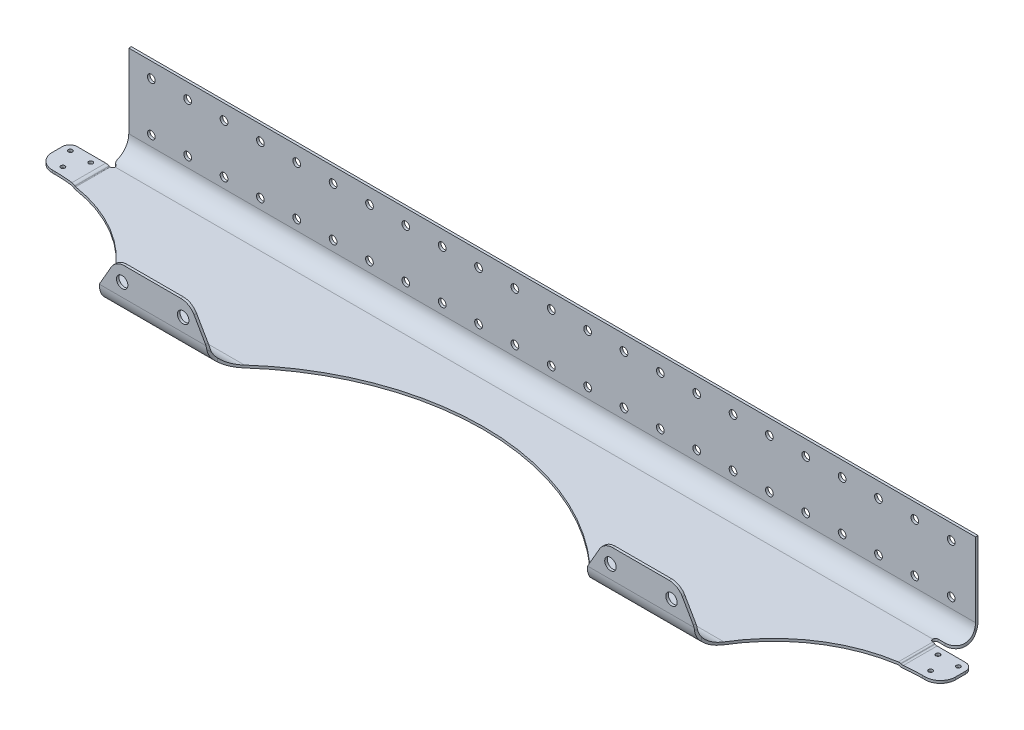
SolidWorks part; units mm, degrees
ref_plane "Front Plane" through (0, 0, 0) normal (1, 0, 0) x (0, 1, 0)
ref_plane "Top Plane" through (0, 0, 0) normal (0, 0, 1) x (0, 1, 0)
ref_plane "Right Plane" through (0, 0, 0) normal (0, 1, 0) x (-1, 0, 0)
sketch "sk 5dia hole pat" plane through (0, 0, 0) normal (0, 0, 1) x (0, 1, 0)
  line L4 (-30.48, -48.26) -> (30.48, -48.26) construction
  point P3 (0, -48.26)
  circle B0 centre (30.48, -579.12) radius 4.826
  circle B1 centre (1188.72, 579.12) radius 4.826
  circle B2 centre (78.74, -579.12) radius 4.826
  circle B3 centre (127, -579.12) radius 4.826
  circle B4 centre (175.26, -579.12) radius 4.826
  circle B5 centre (223.52, -579.12) radius 4.826
  circle B6 centre (271.78, -579.12) radius 4.826
  circle B7 centre (320.04, -579.12) radius 4.826
  circle B8 centre (368.3, -579.12) radius 4.826
  circle B9 centre (416.56, -579.12) radius 4.826
  circle B10 centre (464.82, -579.12) radius 4.826
  circle B11 centre (513.08, -579.12) radius 4.826
  circle B12 centre (561.34, -579.12) radius 4.826
  circle B13 centre (609.6, -579.12) radius 4.826
  circle B14 centre (657.86, -579.12) radius 4.826
  circle B15 centre (706.12, -579.12) radius 4.826
  circle B16 centre (754.38, -579.12) radius 4.826
  circle B17 centre (802.64, -579.12) radius 4.826
  circle B18 centre (850.9, -579.12) radius 4.826
  circle B19 centre (899.16, -579.12) radius 4.826
  circle B20 centre (947.42, -579.12) radius 4.826
  circle B21 centre (995.68, -579.12) radius 4.826
  circle B22 centre (1043.94, -579.12) radius 4.826
  circle B23 centre (1092.2, -579.12) radius 4.826
  circle B24 centre (1140.46, -579.12) radius 4.826
  circle B25 centre (1188.72, -579.12) radius 4.826
  circle B26 centre (30.48, -530.86) radius 4.826
  circle B27 centre (30.48, -482.6) radius 4.826
  circle B28 centre (30.48, -434.34) radius 4.826
  circle B29 centre (30.48, -386.08) radius 4.826
  circle B30 centre (30.48, -337.82) radius 4.826
  circle B31 centre (30.48, -289.56) radius 4.826
  circle B32 centre (30.48, -241.3) radius 4.826
  circle B33 centre (30.48, -193.04) radius 4.826
  circle B34 centre (30.48, -144.78) radius 4.826
  circle B35 centre (30.48, -96.52) radius 4.826
  circle B36 centre (30.48, -48.26) radius 4.826
  circle B37 centre (30.48, 0) radius 4.826
  circle B38 centre (30.48, 48.26) radius 4.826
  circle B39 centre (30.48, 96.52) radius 4.826
  circle B40 centre (30.48, 144.78) radius 4.826
  circle B41 centre (30.48, 193.04) radius 4.826
  circle B42 centre (30.48, 241.3) radius 4.826
  circle B43 centre (30.48, 289.56) radius 4.826
  circle B44 centre (30.48, 337.82) radius 4.826
  circle B45 centre (30.48, 386.08) radius 4.826
  circle B46 centre (30.48, 434.34) radius 4.826
  circle B47 centre (30.48, 482.6) radius 4.826
  circle B48 centre (30.48, 530.86) radius 4.826
  circle B49 centre (30.48, 579.12) radius 4.826
  circle B50 centre (1140.46, 579.12) radius 4.826
  circle B51 centre (1092.2, 579.12) radius 4.826
  circle B52 centre (1043.94, 579.12) radius 4.826
  circle B53 centre (995.68, 579.12) radius 4.826
  circle B54 centre (947.42, 579.12) radius 4.826
  circle B55 centre (899.16, 579.12) radius 4.826
  circle B56 centre (850.9, 579.12) radius 4.826
  circle B57 centre (802.64, 579.12) radius 4.826
  circle B58 centre (754.38, 579.12) radius 4.826
  circle B59 centre (706.12, 579.12) radius 4.826
  circle B60 centre (657.86, 579.12) radius 4.826
  circle B61 centre (609.6, 579.12) radius 4.826
  circle B62 centre (561.34, 579.12) radius 4.826
  circle B63 centre (513.08, 579.12) radius 4.826
  circle B64 centre (464.82, 579.12) radius 4.826
  circle B65 centre (416.56, 579.12) radius 4.826
  circle B66 centre (368.3, 579.12) radius 4.826
  circle B67 centre (320.04, 579.12) radius 4.826
  circle B68 centre (271.78, 579.12) radius 4.826
  circle B69 centre (223.52, 579.12) radius 4.826
  circle B70 centre (175.26, 579.12) radius 4.826
  circle B71 centre (127, 579.12) radius 4.826
  circle B72 centre (78.74, 579.12) radius 4.826
  circle B73 centre (1188.72, 530.86) radius 4.826
  circle B74 centre (1188.72, 482.6) radius 4.826
  circle B75 centre (1188.72, 434.34) radius 4.826
  circle B76 centre (1188.72, 386.08) radius 4.826
  circle B77 centre (1188.72, 337.82) radius 4.826
  circle B78 centre (1188.72, 289.56) radius 4.826
  circle B79 centre (1188.72, 241.3) radius 4.826
  circle B80 centre (1188.72, 193.04) radius 4.826
  circle B81 centre (1188.72, 144.78) radius 4.826
  circle B82 centre (1188.72, 96.52) radius 4.826
  circle B83 centre (1188.72, 48.26) radius 4.826
  circle B84 centre (1188.72, 0) radius 4.826
  circle B85 centre (1188.72, -48.26) radius 4.826
  circle B86 centre (1188.72, -96.52) radius 4.826
  circle B87 centre (1188.72, -144.78) radius 4.826
  circle B88 centre (1188.72, -193.04) radius 4.826
  circle B89 centre (1188.72, -241.3) radius 4.826
  circle B90 centre (1188.72, -289.56) radius 4.826
  circle B91 centre (1188.72, -337.82) radius 4.826
  circle B92 centre (1188.72, -386.08) radius 4.826
  circle B93 centre (1188.72, -434.34) radius 4.826
  circle B94 centre (1188.72, -482.6) radius 4.826
  circle B95 centre (1188.72, -530.86) radius 4.826
  line B96 (609.6, -579.12) -> (609.6, -504.12) construction
  line B97 (30.48, 0) -> (105.48, 0) construction
  circle B98 centre (-30.48, 579.12) radius 4.826
  circle B99 centre (-175.26, -579.12) radius 4.826
  circle B100 centre (-127, -579.12) radius 4.826
  circle B101 centre (-30.48, -579.12) radius 4.826
  circle B102 centre (-1188.72, 96.52) radius 4.826
  circle B103 centre (-127, 579.12) radius 4.826
  circle B104 centre (-464.82, 579.12) radius 4.826
  circle B105 centre (-513.08, 579.12) radius 4.826
  circle B106 centre (-706.12, 579.12) radius 4.826
  circle B107 centre (-754.38, 579.12) radius 4.826
  circle B108 centre (-899.16, 579.12) radius 4.826
  circle B109 centre (-30.48, 530.86) radius 4.826
  circle B110 centre (-30.48, 482.6) radius 4.826
  circle B111 centre (-30.48, 434.34) radius 4.826
  circle B112 centre (-30.48, 386.08) radius 4.826
  circle B113 centre (-30.48, 337.82) radius 4.826
  circle B114 centre (-30.48, 289.56) radius 4.826
  circle B115 centre (-30.48, 241.3) radius 4.826
  circle B116 centre (-30.48, 193.04) radius 4.826
  circle B117 centre (-30.48, 144.78) radius 4.826
  circle B118 centre (-30.48, 96.52) radius 4.826
  circle B119 centre (-30.48, 48.26) radius 4.826
  circle B120 centre (-30.48, 0) radius 4.826
  circle B121 centre (-30.48, -48.26) radius 4.826
  circle B122 centre (-30.48, -96.52) radius 4.826
  circle B123 centre (-30.48, -144.78) radius 4.826
  circle B124 centre (-30.48, -241.3) radius 4.826
  circle B125 centre (-30.48, -289.56) radius 4.826
  circle B126 centre (-30.48, -337.82) radius 4.826
  circle B127 centre (-30.48, -386.08) radius 4.826
  circle B128 centre (-30.48, -434.34) radius 4.826
  circle B129 centre (-30.48, -482.6) radius 4.826
  circle B130 centre (-30.48, -530.86) radius 4.826
  line B131 (-1188.72, 0) -> (-1113.72, 0) construction
  dimension "D1" = 60.96
sketch_block_instance "5dia hole pat-1"
sketch_block "5dia hole pat" parameters "D1"=9.652, "D2"=9.652, "D3"=75
sketch_block_instance "5dia hole pat-2"
sketch "sk 47.986in pnl" plane through (0, 0, 0) normal (0, 0, 1) x (0, 1, 0)
  line B0 (0.1778, 0) -> (1219.0222, 0) construction
  line B1 (0.1778, 609.4222) -> (1219.0222, 609.4222)
  line B2 (0.1778, 609.4222) -> (0.1778, -609.4222)
  line B3 (0.1778, -609.4222) -> (1219.0222, -609.4222)
  line B4 (1219.0222, 609.4222) -> (1219.0222, -609.4222)
  line B5 (609.6, 609.4222) -> (609.6, -609.4222) construction
  dimension "D1" = 30.3022
sketch_block_instance "47.986in pnl-1"
sketch_block "47.986in pnl" parameters "D1"=1218.8444, "D2"=1218.8444
sketch "sk main body" plane through (0, 0, 0) normal (1, 0, 0) x (0, 1, 0)
  line L0 (49.53, 0) -> (-43.18, 0)
  line L1 (-68.58, 25.4) -> (-68.58, 158.75)
  line L2 (-43.18, 184.15) -> (-7.62, 184.15)
  line L3 (-26.67, 213.8401) -> (-26.67, 147.2198) construction
  line L4 (49.53, 3.175) -> (-43.18, 3.175)
  line L5 (-65.405, 25.4) -> (-65.405, 158.75)
  line L6 (-43.18, 180.975) -> (-7.62, 180.975)
  line L7 (-7.62, 184.15) -> (-7.62, 180.975)
  line L8 (49.53, 3.175) -> (49.53, 0)
  line L9 (670.3644, 0) -> (-670.3644, 0) construction
  arc A0 (-43.18, 0) -> (-68.58, 25.4) centre (-43.18, 25.4) cw
  arc A1 (-68.58, 158.75) -> (-43.18, 184.15) centre (-43.18, 158.75) cw
  arc A2 (-43.18, 3.175) -> (-65.405, 25.4) centre (-43.18, 25.4) cw
  arc A3 (-65.405, 158.75) -> (-43.18, 180.975) centre (-43.18, 158.75) cw
  dimension "D2" = 25.4
  dimension "D1" = 19.05
  dimension "D3" = 12.7
  dimension "D4" = 16.51
  dimension "D5" = 19.05
  dimension "D7" = 177.8
  dimension "D6" = 3.175
extrude "main body" add sketch "sk main body" along normal mid plane 1082.88
sketch "sk upper holes" plane through (0, 0, 184.15) normal (0, 0, 1) x (1, 0, 0)
  line L0 (-609.4222, 0.1778) -> (-609.4222, 1219.0222) construction
  line L1 (609.4222, 0.1778) -> (609.4222, 1219.0222) construction
  line L2 (541.44, -7.62) -> (-541.44, -7.62) construction
  circle A2 centre (-342.9, -26.67) radius 16.51 construction
  circle A3 centre (-266.7, -26.67) radius 16.51 construction
  circle A4 centre (266.7, -26.67) radius 16.51 construction
  circle A5 centre (342.9, -26.67) radius 16.51 construction
  line B0 (-342.9, -26.67) -> (-266.7, -26.67) construction
  circle B1 centre (-342.9, -26.67) radius 7.1438
  circle B2 centre (-266.7, -26.67) radius 7.1438
  line B3 (266.7, -26.67) -> (342.9, -26.67) construction
  circle B4 centre (266.7, -26.67) radius 7.1438
  circle B5 centre (342.9, -26.67) radius 7.1438
  dimension "D1" = 304.8
  dimension "D2" = 304.8
  dimension "D6" = 33.02
  dimension "D7" = 33.02
  dimension "D8" = 33.02
  dimension "D9" = 33.02
  dimension "D3" = 304.6222
  dimension "D4" = 304.6222
  dimension "D5" = 19.05
sketch_block_instance "Upper bolt holes-1"
sketch_block "Upper bolt holes" parameters "D1"=14.2875, "D2"=14.2875, "D3"=76.2
sketch_block_instance "Upper bolt holes-2"
sketch "Sketch6" plane through (0, 0, 184.15) normal (0, 0, 1) x (1, 0, 0)
  line L0 (-371.4962, -43.18) -> (-304.8, 72.3411)
  line L1 (541.44, -43.18) -> (-541.44, -43.18) construction
  line L2 (-304.8, 72.3411) -> (-238.1038, -43.18)
  line L3 (-371.4962, -43.18) -> (-638.8127, -43.18)
  line L4 (-638.8127, -43.18) -> (-638.8127, 115.8831)
  line L6 (238.1038, -43.18) -> (304.8, 72.3411)
  line L7 (304.8, 72.3411) -> (371.4962, -43.18)
  line L8 (371.4962, -43.18) -> (645.1619, -43.18)
  line L9 (645.1619, -43.18) -> (645.1619, 115.8831)
  line L10 (-238.1038, -43.18) -> (238.1038, -43.18)
  line L11 (-638.8127, 115.8831) -> (645.1619, 115.8831)
  circle A0 centre (-342.9, -26.67) radius 16.51 construction
  circle A1 centre (-266.7, -26.67) radius 16.51 construction
  circle A2 centre (342.9, -26.67) radius 16.51 construction
  circle A3 centre (266.7, -26.67) radius 16.51 construction
  dimension "D1" = 60
  dimension "D2" = 60
  dimension "D3" = 60
  dimension "D4" = 60
extrude "Upper tabs" cut sketch "Sketch6" against normal blind 10
sketch "Sketch7" plane through (0, 0, 0) normal (0, 1, 0) x (-1, 0, 0)
  line L0 (-238.1038, 180.975) -> (-238.1038, 196.2087)
  line L4 (-238.1038, 196.2087) -> (238.1038, 196.2087)
  line L5 (238.1038, 196.2087) -> (238.1038, 180.975)
  line L6 (-541.44, 25.4) -> (541.44, 25.4) construction
  arc A2 (-238.1038, 180.975) -> (238.1038, 180.975) centre (0, 399.136) ccw
  point P2 (0, 76.2)
  dimension "D1" = 50.8
extrude "Side Mid curve" cut sketch "Sketch7" against normal through all
sketch "5dia hole for part" plane through (0, 0, 0) normal (0, 0, 1) x (0, 1, 0)
  line L0 (49.53, -541.44) -> (-43.18, -541.44) construction
  line L1 (49.53, -541.44) -> (49.53, 541.44) construction
  line L2 (-43.18, -541.44) -> (-43.18, 541.44) construction
  circle A2 centre (30.48, 396.6709) radius 4.826
  circle A3 centre (-30.48, 396.6709) radius 4.826
  circle A52 centre (-30.48, -511.1378) radius 4.826
  circle A53 centre (30.48, -511.1378) radius 4.826
  circle A54 centre (30.48, -465.7474) radius 4.826
  circle A55 centre (-30.48, -465.7474) radius 4.826
  circle A56 centre (30.48, -420.3569) radius 4.826
  circle A57 centre (-30.48, -420.3569) radius 4.826
  circle A58 centre (30.48, -374.9665) radius 4.826
  circle A59 centre (-30.48, -374.9665) radius 4.826
  circle A60 centre (30.48, -329.5761) radius 4.826
  circle A61 centre (-30.48, -329.5761) radius 4.826
  circle A62 centre (30.48, -284.1856) radius 4.826
  circle A63 centre (-30.48, -284.1856) radius 4.826
  circle A64 centre (30.48, -238.7952) radius 4.826
  circle A65 centre (-30.48, -238.7952) radius 4.826
  circle A66 centre (30.48, -193.4048) radius 4.826
  circle A67 centre (-30.48, -193.4048) radius 4.826
  circle A68 centre (30.48, -148.0143) radius 4.826
  circle A69 centre (-30.48, -148.0143) radius 4.826
  circle A70 centre (30.48, -102.6239) radius 4.826
  circle A71 centre (-30.48, -102.6239) radius 4.826
  circle A72 centre (30.48, -57.2335) radius 4.826
  circle A73 centre (-30.48, -57.2335) radius 4.826
  circle A74 centre (30.48, -11.843) radius 4.826
  circle A75 centre (-30.48, -11.843) radius 4.826
  circle A76 centre (30.48, 33.5474) radius 4.826
  circle A77 centre (-30.48, 33.5474) radius 4.826
  circle A78 centre (30.48, 78.9378) radius 4.826
  circle A79 centre (-30.48, 78.9378) radius 4.826
  circle A80 centre (30.48, 124.3283) radius 4.826
  circle A81 centre (-30.48, 124.3283) radius 4.826
  circle A82 centre (30.48, 169.7187) radius 4.826
  circle A83 centre (-30.48, 169.7187) radius 4.826
  circle A84 centre (30.48, 215.1091) radius 4.826
  circle A85 centre (-30.48, 215.1091) radius 4.826
  circle A86 centre (30.48, 260.4996) radius 4.826
  circle A87 centre (-30.48, 260.4996) radius 4.826
  circle A88 centre (30.48, 305.89) radius 4.826
  circle A89 centre (-30.48, 305.89) radius 4.826
  circle A90 centre (30.48, 351.2805) radius 4.826
  circle A91 centre (-30.48, 351.2805) radius 4.826
  circle A92 centre (30.48, 442.0613) radius 4.826
  circle A93 centre (-30.48, 442.0613) radius 4.826
  circle A94 centre (30.48, 487.4518) radius 4.826
  circle A95 centre (-30.48, 487.4518) radius 4.826
  dimension "D4" = 9.652
  dimension "D5" = 9.652
  dimension "D1" = 30.3022
  dimension "D2" = 19.05
  dimension "D3" = 12.7
  dimension "D6" = 23
extrude "Holes Bot" cut sketch "5dia hole for part" along normal blind 10
extrude "Holes Top" cut sketch "sk upper holes" against normal blind 10
ref_plane "Tab Lower pln" through (0, 0, 25.4) normal (0, 0, 1) x (0, 1, 0)
sketch "sk Rivet holes" plane through (0, 0, 0) normal (0, 1, 0) x (-1, 0, 0)
  line L1 (541.44, 0) -> (541.44, 3.175) construction
  line L3 (64.9605, 25.4) -> (-64.9605, 25.4) construction
  line L5 (-541.44, 25.4) -> (-541.44, 158.75) construction
  circle A0 centre (554.3178, 37.4) radius 10 construction
  circle A1 centre (541.6178, 59.397) radius 10 construction
  circle A2 centre (528.9178, 37.4) radius 10 construction
  circle A3 centre (-541.6178, 59.397) radius 10 construction
  circle A4 centre (-528.9178, 37.4) radius 10 construction
  circle A6 centre (-554.3178, 37.4) radius 10 construction
  point P5 (554.3178, 34.8092)
  point P9 (554.3178, 27.4)
  point P20 (564.3178, 37.4)
  point P21 (-564.3178, 37.4)
  point P22 (518.9178, 37.4)
  point P23 (-518.9178, 37.4)
  point P24 (541.6178, 69.397)
  point P25 (-541.6178, 69.397)
  line B0 (528.9178, 37.4) -> (541.6178, 59.397) construction
  line B1 (541.6178, 59.397) -> (554.3178, 37.4) construction
  line B2 (554.3178, 37.4) -> (528.9178, 37.4) construction
  circle B3 centre (528.9178, 37.4) radius 2.5908
  circle B4 centre (554.3178, 37.4) radius 2.5908
  circle B5 centre (541.6178, 59.397) radius 2.5908
  line B6 (535.2678, 48.3985) -> (541.6178, 44.7323) construction
  line B7 (541.6178, 37.4) -> (541.6178, 44.7323) construction
  line B8 (-554.3178, 37.4) -> (-541.6178, 59.397) construction
  line B9 (-541.6178, 59.397) -> (-528.9178, 37.4) construction
  line B10 (-528.9178, 37.4) -> (-554.3178, 37.4) construction
  circle B11 centre (-554.3178, 37.4) radius 2.5908
  circle B12 centre (-528.9178, 37.4) radius 2.5908
  circle B13 centre (-541.6178, 59.397) radius 2.5908
  line B14 (-547.9678, 48.3985) -> (-541.6178, 44.7323) construction
  line B15 (-541.6178, 37.4) -> (-541.6178, 44.7323) construction
  dimension "D4" = 20
  dimension "D6" = 20
  dimension "D7" = 20
  dimension "D8" = 20
  dimension "D9" = 20
  dimension "D10" = 20
  dimension "D1" = 0.1778
  dimension "D2" = 12
  dimension "D3" = 0.1778
  dimension "D5" = 7.4092
sketch_block_instance "Blind Rivet holes-1"
sketch_block "Blind Rivet holes" parameters "D1"=5.1816, "D2"=5.1816, "D3"=5.1816, "D4"=60, "D5"=60, "D6"=25.4, "D7"=25.4, "D8"=25.4
sketch_block_instance "Blind Rivet holes-2"
sketch "sk Vtab" plane through (0, 0, 25.4) normal (0, 0, 1) x (0, 1, 0)
  line L8 (-68.58, -541.44) -> (-68.58, 541.44) construction
  line B0 (-68.58, 511.4887) -> (-68.58, 513.4887)
  line B1 (-67.9101, 515.9887) -> (-67.6624, 516.4178)
  line B2 (-66.9925, 518.9178) -> (-66.9925, 563.9178)
  line B3 (-65.405, 511.4887) -> (-65.405, 513.4887)
  line B4 (-65.1605, 514.4012) -> (-64.9127, 514.8303)
  line B5 (-63.8175, 518.9178) -> (-63.8175, 563.9178)
  line B6 (-68.58, 511.4887) -> (-65.405, 511.4887)
  line B7 (-63.8175, 563.9178) -> (-66.9925, 563.9178)
  arc B8 (-67.6624, 516.4178) -> (-66.9925, 518.9178) centre (-71.9925, 518.9178) ccw
  arc B9 (-68.58, 513.4887) -> (-67.9101, 515.9887) centre (-63.58, 513.4887) cw
  arc B10 (-65.405, 513.4887) -> (-65.1605, 514.4012) centre (-63.58, 513.4887) cw
  arc B11 (-64.9127, 514.8303) -> (-63.8175, 518.9178) centre (-71.9925, 518.9178) ccw
  line B12 (-65.405, -511.4887) -> (-65.405, -513.4887)
  line B13 (-66.0749, -515.9887) -> (-66.3226, -516.4178)
  line B14 (-66.9925, -518.9178) -> (-66.9925, -563.9178)
  line B15 (-68.58, -511.4887) -> (-68.58, -513.4887)
  line B16 (-68.8245, -514.4012) -> (-69.0723, -514.8303)
  line B17 (-70.1675, -518.9178) -> (-70.1675, -563.9178)
  line B18 (-65.405, -511.4887) -> (-68.58, -511.4887)
  line B19 (-70.1675, -563.9178) -> (-66.9925, -563.9178)
  arc B20 (-66.3226, -516.4178) -> (-66.9925, -518.9178) centre (-61.9925, -518.9178) ccw
  arc B21 (-65.405, -513.4887) -> (-66.0749, -515.9887) centre (-70.405, -513.4887) cw
  arc B22 (-68.58, -513.4887) -> (-68.8245, -514.4012) centre (-70.405, -513.4887) cw
  arc B23 (-69.0723, -514.8303) -> (-70.1675, -518.9178) centre (-61.9925, -518.9178) ccw
sketch_block_instance "V tab-1"
sketch_block "V tab" parameters "D3"=5, "D1"=30, "D2"=1.5875, "D4"=2, "D5"=24.625
sketch_block_instance "V tab-2"
sketch "sk Vtab precut" plane through (0, 0, 25.4) normal (0, 0, 1) x (0, 1, 0)
  line L1 (-68.58, 513.4887) -> (-25.5629, 513.4887)
  line L2 (-68.58, 513.4887) -> (-68.58, 628.7058)
  line L3 (-68.58, 628.7058) -> (-25.5629, 628.7058)
  line L4 (-25.5629, 513.4887) -> (-25.5629, 628.7058)
  line L5 (-68.58, -513.4887) -> (-35.8904, -513.4887)
  line L6 (-68.58, -513.4887) -> (-68.58, -622.8382)
  line L7 (-68.58, -622.8382) -> (-35.8904, -622.8382)
  line L8 (-35.8904, -513.4887) -> (-35.8904, -622.8382)
sketch "Sketch9" plane through (0, 0, 0) normal (0, 1, 0) x (-1, 0, 0)
  line L6 (371.4962, 180.975) -> (371.4962, 193.3104)
  line L7 (371.4962, 193.3104) -> (736.1624, 193.3104)
  line L8 (736.1624, 193.3104) -> (736.1624, 69.397)
  line L9 (736.1624, 69.397) -> (541.6178, 69.397)
  line L10 (-371.4962, 180.975) -> (-371.4962, 190.6931)
  line L11 (-371.4962, 190.6931) -> (-686.7988, 190.6931)
  line L12 (-686.7988, 190.6931) -> (-686.7988, 69.397)
  line L13 (-686.7988, 69.397) -> (-541.6178, 69.397)
  arc A2 (371.4962, 180.975) -> (541.6178, 69.397) centre (541.6178, 254.8773) ccw
  arc A3 (-371.4962, 180.975) -> (-541.6178, 69.397) centre (-541.6178, 254.8773) cw
  circle A4 centre (-541.6178, 59.397) radius 10 construction
extrude "Cut-Extrude5" cut sketch "sk Vtab precut" along normal through all
extrude "Side Tabs" add sketch "sk Vtab" along normal blind 50
sketch "Sketch11" plane through (0, 0, 0) normal (0, 1, 0) x (-1, 0, 0)
  line L0 (513.4887, 25.4) -> (667.6325, 25.4) construction
  line L1 (513.4887, 28.575) -> (667.6325, 28.575)
  line L2 (513.4887, 22.225) -> (667.6325, 22.225)
  line L4 (-513.4887, 25.4) -> (513.4887, 25.4) construction
  line L5 (513.4887, 75.4) -> (513.4887, 25.4) construction
  line L6 (-513.4887, 25.4) -> (-658.6998, 25.4) construction
  line L7 (-513.4887, 22.225) -> (-658.6998, 22.225)
  line L8 (-513.4887, 28.575) -> (-658.6998, 28.575)
  line L9 (-513.4887, 25.4) -> (-513.4887, 75.4) construction
  arc A0 (513.4887, 28.575) -> (513.4887, 22.225) centre (513.4887, 25.4) ccw
  arc A1 (667.6325, 22.225) -> (667.6325, 28.575) centre (667.6325, 25.4) ccw
  arc A2 (-513.4887, 22.225) -> (-513.4887, 28.575) centre (-513.4887, 25.4) ccw
  arc A3 (-658.6998, 28.575) -> (-658.6998, 22.225) centre (-658.6998, 25.4) ccw
  point P2 (590.5606, 25.4)
  point P7 (-586.0942, 25.4)
  dimension "D1" = 3.175
  dimension "D2" = 3.175
extrude "tab undercut" cut sketch "Sketch11" against normal through all
extrude "Outer curve cut" cut sketch "Sketch9" against normal through all
fillet "Fillet1" radius 19.05 12 edges at (-541.44, -66.7789, 22.225) (541.44, -66.7789, 22.225) (563.9178, -68.58, 69.397) (-563.9178, -65.405, 69.397) (-371.4962, -49.3284, 180.975) (-238.1038, -49.3284, 180.975) (371.4962, -49.3284, 180.975) (238.1038, -49.3284, 180.975) (350.9656, -7.62, 182.5625) (258.6344, -7.62, 182.5625) (-258.6344, -7.62, 182.5625) (-350.9656, -7.62, 182.5625)
fillet "Fillet3" radius 9.525 6 edges at (563.9178, -68.58, 28.575) (-563.9178, -65.405, 28.575) (237.1094, -44.9024, 182.4383) (371.6608, -43.4652, 182.5469) (-237.1094, -44.9024, 182.4383) (-371.6608, -43.4652, 182.5469)
extrude "Tab Holes" cut sketch "sk Rivet holes" against normal through all
sketch "Sketch13" plane through (0, 0, 0) normal (0, 1, 0) x (-1, 0, 0)
  line L1 (545.4014, 24.2519) -> (515.6146, 24.2519)
  line L2 (545.4014, 24.2519) -> (545.4014, -10.4947)
  line L3 (545.4014, -10.4947) -> (515.6146, -10.4947)
  line L4 (515.6146, 24.2519) -> (515.6146, -10.4947)
  line L5 (541.44, 0) -> (541.44, 3.175) construction
  dimension "D1" = 25.8254
extrude "Cut-Extrude7" cut sketch "Sketch13" against normal through all both and the other way through all
fillet "Fillet5" radius 6.35 1 edges at (-515.6146, -66.7789, 22.225)
equation "\"3i\"=138.375"
equation "\".75i\"=12.7"
